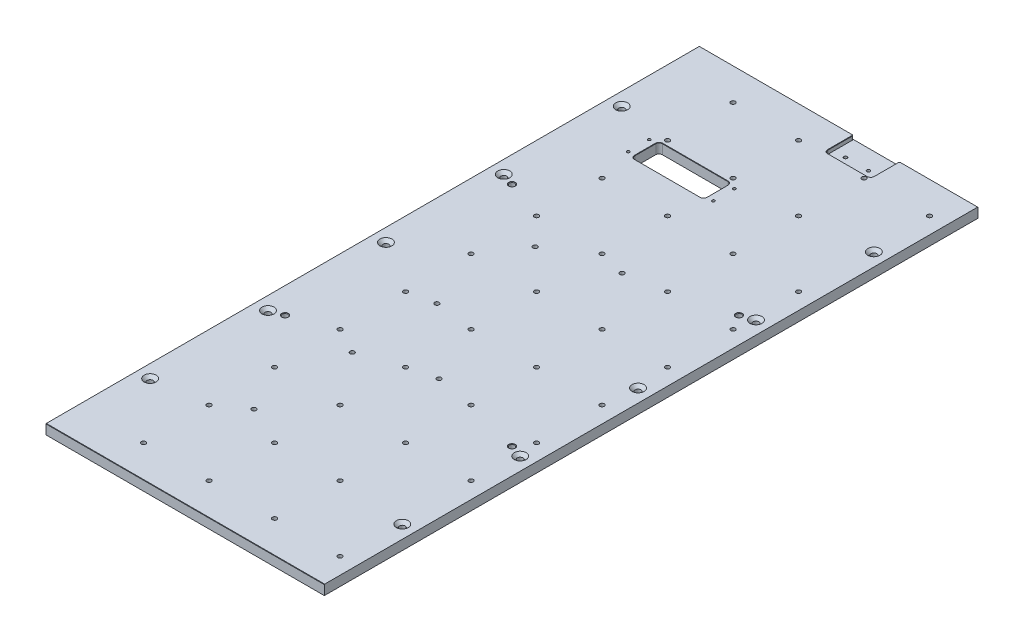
SolidWorks part; units mm, degrees
ref_plane "Ebene vorne" through (0, 0, 0) normal (0, 0, 1) x (1, 0, 0)
ref_plane "Ebene oben" through (0, 0, 0) normal (0, 1, 0) x (1, 0, 0)
ref_plane "Ebene rechts" through (0, 0, 0) normal (1, 0, 0) x (0, 0, -1)
sketch "Skizze1" plane through (0, 0, 0) normal (0, 1, 0) x (1, 0, 0)
  line L0 (-688, 499) -> (-748, 439)
  line L1 (-688, -499) -> (688, -499)
  line L2 (-688, -499) -> (-688, 499) construction
  line L3 (-688, 499) -> (688, 499)
  line L4 (688, -499) -> (688, 499) construction
  line L5 (-688, -499) -> (688, 499) construction
  line L6 (-688, 499) -> (688, -499) construction
  line L7 (-748, 439) -> (-748, -439)
  line L8 (-688, -499) -> (-748, -439)
  line L10 (688, -499) -> (748, -439)
  line L11 (748, -439) -> (748, 439)
  line L12 (748, 439) -> (688, 499)
  line L13 (-748, 0) -> (0, 0) construction
  point P0 (0, 0)
  dimension "D1" = 1496
  dimension "D2" = 998
  dimension "D3" = 60
  dimension "D4" = 45
extrude "Aufsatz-Linear austragen1" add sketch "Skizze1" along normal blind 15
hole_wizard "HORST900_P1_M8 Gewindebohrung1" positions "Skizze4" profile "Skizze5" tap size "M8" standard "DIN"
sketch "Skizze4" plane through (0, 15, 0) normal (0, 1, 0) x (1, 0, 0)
  line L0 (-688, -499) -> (688, -499) construction
  line L1 (0, -181.5) -> (-197.5, -181.5) construction
  line L2 (-197.5, -181.5) -> (0, 16) construction
  line L3 (0, 16) -> (197.5, -181.5) construction
  line L4 (197.5, -181.5) -> (0, -379) construction
  line L5 (0, -379) -> (-197.5, -181.5) construction
  line L7 (-139.6536, -321.1536) -> (139.6536, -41.8464) construction
  line L8 (-139.6536, -41.8464) -> (139.6536, -321.1536) construction
  circle A0 centre (0, -181.5) radius 197.5 construction
  point P21 (-139.6536, -321.1536)
  point P22 (139.6536, -41.8464)
  point P23 (-139.6536, -41.8464)
  point P24 (139.6536, -321.1536)
  dimension "D1" = 395
  dimension "D2" = 120
sketch "Skizze5" plane through (139.6536, 15, 321.1536) normal (1, 0, 0) x (0, 0, 1)
  line L0 (0, 0) -> (0, 15)
  line L1 (0, 15) -> (3.4, 15)
  line L2 (3.4, 15) -> (3.4, 0)
  line L5 (3.4, 0) -> (0, 0)
  line L11 (0, -6.35) -> (0, 107.95) construction
  dimension "Bohrerdurchmesser" = 6.8
  dimension "Bohrungstiefe" = 15
hole_wizard "HORST900_P2_M8 Gewindebohrung1" positions "Skizze6" profile "Skizze7" tap size "M8" standard "DIN"
sketch "Skizze6" plane through (0, 15, 0) normal (0, 1, 0) x (1, 0, 0)
  line L1 (240.8464, -139.6536) -> (520.1536, -139.6536) construction
  line L2 (240.8464, -139.6536) -> (240.8464, 139.6536) construction
  line L3 (240.8464, 139.6536) -> (520.1536, 139.6536) construction
  line L4 (520.1536, -139.6536) -> (520.1536, 139.6536) construction
  line L5 (240.8464, -139.6536) -> (520.1536, 139.6536) construction
  line L6 (240.8464, 139.6536) -> (520.1536, -139.6536) construction
  line L7 (748, -439) -> (748, 439) construction
  circle A0 centre (380.5, 0) radius 197.5 construction
  point P5 (520.1536, 139.6536)
  point P8 (240.8464, -139.6536)
  point P9 (240.8464, 139.6536)
  point P10 (520.1536, -139.6536)
  dimension "D1" = 395
  dimension "D2" = 170
sketch "Skizze7" plane through (520.1536, 15, 139.6536) normal (1, 0, 0) x (0, 0, 1)
  line L0 (0, 0) -> (0, 15)
  line L1 (0, 15) -> (3.4, 15)
  line L2 (3.4, 15) -> (3.4, 0)
  line L5 (3.4, 0) -> (0, 0)
  line L11 (0, -6.35) -> (0, 107.95) construction
  dimension "Bohrerdurchmesser" = 6.8
  dimension "Bohrungstiefe" = 15
hole_wizard "Raster_M8 Gewindebohrung3" positions "Skizze9" profile "Skizze10" tap size "M8" standard "DIN"
sketch "Skizze9" plane through (0, 15, 0) normal (0, 1, 0) x (1, 0, 0)
  point P0 (-700, -450)
  dimension "D1" = 700
  dimension "D2" = 450
sketch "Skizze10" plane through (-700, 15, 450) normal (1, 0, 0) x (0, 0, 1)
  line L0 (0, 0) -> (0, 15)
  line L1 (0, 15) -> (3.4, 15)
  line L2 (3.4, 15) -> (3.4, 0)
  line L5 (3.4, 0) -> (0, 0)
  line L11 (0, -6.35) -> (0, 107.95) construction
  dimension "Bohrerdurchmesser" = 6.8
  dimension "Bohrungstiefe" = 15
pattern_linear "HORST900P3_M8 Gewindebohrung1" count 2 spacing 150 along (0, 0, -1) of "HORST900_P1_M8 Gewindebohrung1"
hole_wizard "Formsenkung für M8 Senkschraube mit Innensechskant1" positions "Skizze2" profile "Skizze3" countersink size "M8" standard "DIN"
sketch "Skizze2" plane through (0, 15, 0) normal (0, 1, 0) x (1, 0, 0)
  line L1 (445, -360) -> (-445, -360)
  line L2 (445, -360) -> (445, 360)
  line L3 (445, 360) -> (-445, 360)
  line L4 (-445, -360) -> (-445, 360)
  line L5 (445, -360) -> (-445, 360) construction
  line L6 (445, 360) -> (-445, -360) construction
  line L7 (0, 0) -> (-610.081, 0) construction
  line L8 (-555, 210) -> (-555, -210) construction
  line L13 (0, 0) -> (0, -385.3386) construction
  line L18 (555, 210) -> (555, -210) construction
  line L19 (-20, 360) -> (-20, -360)
  line L21 (20, 360) -> (20, -360)
  line L22 (-555, 250) -> (-555, 210) construction
  line L24 (-555, -210) -> (-555, -250) construction
  line L26 (555, -210) -> (555, -250) construction
  line L28 (555, 210) -> (555, 250) construction
  line L29 (445, 0) -> (405, 0) construction
  point P2 (-445, 360)
  point P5 (445, -360)
  point P6 (445, 360)
  point P7 (-445, -360)
  point P98 (-555, 210)
  point P100 (-555, -210)
  point P123 (555, 210)
  point P125 (555, -210)
  point P139 (-20, 360)
  point P142 (20, 360)
  point P145 (-20, -360)
  point P148 (20, -360)
  point P150 (-20, 0)
  point P152 (20, 0)
  point P174 (-555, 250)
  point P177 (-555, -250)
  point P180 (555, -250)
  point P183 (555, 250)
  point P184 (-405, 360)
  point P186 (405, 360)
  point P188 (405, -360)
  point P190 (-405, -360)
  point P191 (-445, 0)
  point P193 (-405, 0)
  point P195 (445, 0)
  point P197 (405, 0)
  dimension "D1" = 890
  dimension "D2" = 720
  dimension "D3" = 40
  dimension "D4" = 1110
  dimension "D5" = 500
  dimension "D6" = 40
  dimension "D7" = 40
  dimension "D8" = 40
  dimension "D9" = 40
  dimension "D10" = 40
  dimension "D11" = 40
  dimension "D12" = 40
sketch "Skizze3" plane through (-445, 15, -360) normal (1, 0, 0) x (0, 0, 1)
  line L0 (0, 0) -> (0, 15)
  line L1 (0, 15) -> (4.5, 15)
  line L2 (4.5, 15) -> (4.5, 4.625)
  line L3 (4.5, 4.625) -> (9.125, 0)
  line L5 (9.125, 0) -> (0, 0)
  line L6 (-4.5, 4.625) -> (-9.125, 0) construction
  line L11 (0, -6.35) -> (0, 107.95) construction
  dimension "Bohrerdurchmesser" = 9
  dimension "Bohrungstiefe" = 15
  dimension "Senkdurchmesser (Oben)" = 18.25
  dimension "Senkwinkel (Oben)" = 90
sketch "Skizze8" plane through (0, 15, 0) normal (0, 1, 0) x (1, 0, 0)
  line L1 (100, 300) -> (200, 300)
  line L2 (95, 305) -> (95, 337)
  line L3 (100, 342) -> (200, 342)
  line L4 (205, 305) -> (205, 337)
  line L5 (95, 300) -> (205, 342) construction
  line L6 (95, 342) -> (205, 300) construction
  arc A0 (95, 305) -> (100, 300) centre (100, 305) ccw
  arc A1 (200, 300) -> (205, 305) centre (200, 305) ccw
  arc A2 (205, 337) -> (200, 342) centre (200, 337) ccw
  arc A3 (100, 342) -> (95, 337) centre (100, 337) ccw
  point P0 (150, 321)
  dimension "D5" = 5
  dimension "D1" = 150
  dimension "D2" = 110
  dimension "D3" = 42
  dimension "D4" = 321
extrude "Schnitt-Linear austragen1" cut sketch "Skizze8" against normal through all
hole_wizard "M5 Gewindebohrung1" positions "Skizze17" profile "Skizze18" tap size "M5" standard "DIN"
sketch "Skizze17" plane through (0, 15, 0) normal (0, 1, 0) x (1, 0, 0)
  line L0 (150, 342) -> (150, 300) construction
  line L1 (200, 342) -> (100, 342) construction
  line L2 (100, 300) -> (200, 300) construction
  line L3 (95, 321) -> (150, 321) construction
  line L4 (95, 337) -> (95, 305) construction
  line L5 (150, 321) -> (205, 321) construction
  line L6 (205, 305) -> (205, 337) construction
  point P17 (85, 337)
  point P19 (85, 305)
  point P21 (215, 305)
  point P23 (215, 337)
  dimension "D1" = 32
  dimension "D2" = 130
sketch "Skizze18" plane through (215, 15, -337) normal (1, 0, 0) x (0, 0, 1)
  line L0 (0, 0) -> (0, 13.2618)
  line L1 (0, 13.2618) -> (2.1, 12)
  line L2 (2.1, 12) -> (2.1, 0)
  line L5 (2.1, 0) -> (0, 0)
  line L10 (0, 13.2618) -> (-2.1, 12) construction
  line L11 (0, -6.35) -> (0, 107.95) construction
  dimension "Bohrerdurchmesser" = 4.2
  dimension "Bohrungstiefe" = 12
  dimension "Spitzenwinkel" = 118
sketch "Skizze11" plane through (0, 15, 0) normal (0, 1, 0) x (1, 0, 0)
  line L0 (0, 0) -> (0, 417.1845) construction
  line L1 (688, 499) -> (-688, 499) construction
  line L2 (-270, 455) -> (-270, 499) construction
  line L3 (-305.1, 499) -> (-234.9, 499)
  line L4 (-305.1, 499) -> (-305.1, 460)
  line L5 (-300.1, 455) -> (-239.9, 455)
  line L6 (-234.9, 499) -> (-234.9, 460)
  line L7 (234.9, 499) -> (234.9, 460)
  line L8 (300.1, 455) -> (239.9, 455)
  line L9 (305.1, 499) -> (305.1, 460)
  line L10 (305.1, 499) -> (234.9, 499)
  arc A0 (-234.9, 460) -> (-239.9, 455) centre (-239.9, 460) cw
  arc A1 (-300.1, 455) -> (-305.1, 460) centre (-300.1, 460) cw
  arc A2 (300.1, 455) -> (305.1, 460) centre (300.1, 460) ccw
  arc A3 (234.9, 460) -> (239.9, 455) centre (239.9, 460) ccw
  point P12 (-234.9, 455)
  point P15 (-305.1, 455)
  point P25 (305.1, 455)
  point P26 (234.9, 455)
  dimension "D3" = 5
  dimension "D1" = 44
  dimension "D2" = 70.2
  dimension "D4" = 270
extrude "Schnitt-Linear austragen2" cut sketch "Skizze11" against normal blind 6
fillet "Verrundung2" radius 2 4 edges at (-234.9, 12, -499) (-305.1, 12, -499) (305.1, 12, -499) (234.9, 12, -499)
hole_wizard "M6 Gewindebohrung1" positions "Skizze12" profile "Skizze13" tap size "M6" standard "DIN"
sketch "Skizze12" plane through (0, 9, 0) normal (0, 1, 0) x (1, 0, 0)
  line L0 (-270, 95.0617) -> (-270, 469.2) construction
  line L1 (-270, 469.2) -> (-287.5, 469.2) construction
  line L3 (-270, 469.2) -> (-252.5, 469.2) construction
  line L6 (-300.1, 455) -> (-239.9, 455) construction
  line L7 (-270, 469.2) -> (-270, 499) construction
  line L8 (-232.9, 499) -> (-307.1, 499) construction
  point P0 (-287.5, 469.2)
  point P4 (-252.5, 469.2)
  dimension "D1" = 35
  dimension "D2" = 14.2
sketch "Skizze13" plane through (-287.5, 9, -469.2) normal (1, 0, 0) x (0, 0, 1)
  line L0 (0, 0) -> (0, 9)
  line L1 (0, 9) -> (2.5, 9)
  line L2 (2.5, 9) -> (2.5, 0)
  line L5 (2.5, 0) -> (0, 0)
  line L11 (0, -6.35) -> (0, 107.95) construction
  dimension "Bohrerdurchmesser" = 5
  dimension "Bohrungstiefe" = 9
mirror "Spiegeln3" about plane through (0, 0, 0) normal (1, 0, 0) of "HORST900_P2_M8 Gewindebohrung1"
mirror "Spiegeln2" about plane through (0, 0, 0) normal (1, 0, 0) of "M6 Gewindebohrung1"
pattern_linear "Raster_M8 Gewindebohrung4" count 15 spacing 100 along (1, 0, 0) count 10 spacing 100 along (0, 0, -1) of "Raster_M8 Gewindebohrung3"
hole_wizard "Ø5.0mm Stiftloch1" positions "Skizze14" profile "Skizze15" hole size "Ø5.0" standard "DIN"
sketch "Skizze14" plane through (0, 15, 0) normal (0, 1, 0) x (1, 0, 0)
  line L1 (-500, -225) -> (500, -225)
  line L2 (-500, -225) -> (-500, 225)
  line L3 (-500, 225) -> (500, 225)
  line L4 (500, -225) -> (500, 225)
  line L5 (-500, -225) -> (500, 225) construction
  line L6 (-500, 225) -> (500, -225) construction
  point P2 (500, 225)
  point P5 (-500, -225)
  point P6 (-500, 225)
  point P7 (500, -225)
  dimension "D1" = 1000
  dimension "D2" = 450
sketch "Skizze15" plane through (500, 15, -225) normal (1, 0, 0) x (0, 0, 1)
  line L0 (0, 0) -> (0, 9.5022)
  line L1 (0, 9.5022) -> (2.5, 8)
  line L2 (2.5, 8) -> (2.5, 0)
  line L5 (2.5, 0) -> (0, 0)
  line L10 (0, 9.5022) -> (-2.5, 8) construction
  line L11 (0, -6.35) -> (0, 107.95) construction
  dimension "Bohrerdurchmesser" = 5
  dimension "Bohrungstiefe" = 8
  dimension "Spitzenwinkel" = 118
sketch "Skizze19" plane through (0, 15, 0) normal (0, 1, 0) x (1, 0, 0)
  line L0 (-748, -335.3333) -> (-584.3333, -499)
  line L1 (-748, 439) -> (-748, -439) construction
  line L2 (-688, -499) -> (688, -499) construction
  line L3 (-700, -450) -> (-666.6667, -416.6667) construction
  line L4 (-666.6667, -416.6667) -> (-633.3333, -383.3333) construction
  line L5 (-633.3333, -383.3333) -> (-600, -350) construction
  line L7 (-748, -335.3333) -> (-748, -499)
  line L8 (-748, -499) -> (-584.3333, -499)
  line L9 (0, 0) -> (-867.3636, 0) construction
  line L10 (0, 0) -> (0, 198.8508) construction
  line L11 (748, 335.3333) -> (584.3333, 499)
  line L12 (748, 335.3333) -> (748, 499)
  line L13 (748, 499) -> (584.3333, 499)
  line L14 (748, -499) -> (584.3333, -499)
  line L15 (-748, 499) -> (-584.3333, 499)
  line L16 (-748, 335.3333) -> (-748, 499)
  line L17 (-748, 335.3333) -> (-584.3333, 499)
  line L18 (748, -335.3333) -> (748, -499)
  line L19 (748, -335.3333) -> (584.3333, -499)
extrude "Schnitt-Linear austragen4" cut sketch "Skizze19" against normal through all
fillet "Verrundung1" radius 10 8 edges at (-584.3333, 7.5, 499) (584.3333, 7.5, 499) (748, 7.5, 335.3333) (748, 7.5, -335.3333) (584.3333, 7.5, -499) (-584.3333, 7.5, -499) (-748, 7.5, -335.3333) (-748, 7.5, 335.3333)
chamfer "Fase1" distance 0.5 angle 45 40 edges at (0, 15, -499) (-234.3142, 15, -498.4142) (234.3142, 15, -498.4142) (-234.9, 15, -478.5) (234.9, 15, -478.5) (-236.3645, 15, -456.4645) (236.3645, 15, -456.4645) (-270, 15, -455) (270, 15, -455) (-303.6355, 15, -456.4645) (303.6355, 15, -456.4645) (-305.1, 15, -478.5) (305.1, 15, -478.5) (-305.6858, 15, -498.4142) (305.6858, 15, -498.4142) (-443.6456, 15, -499) (443.6456, 15, -499) (-748, 15, 0) (748, 15, 0) (0, 15, 499) (150, 15, -300) (203.5355, 15, -301.4645) (96.4645, 15, -301.4645) (205, 15, -321) (95, 15, -321) (203.5355, 15, -340.5355) (96.4645, 15, -340.5355) (150, 15, -342) (-666.1667, 15, 417.1667) (-584.018, 15, 498.2388) (-584.018, 15, -498.2388) (584.018, 15, -498.2388) (-666.1667, 15, -417.1667) (666.1667, 15, -417.1667) (-747.2388, 15, -335.018) (747.2388, 15, -335.018) (-747.2388, 15, 335.018) (747.2388, 15, 335.018) (666.1667, 15, 417.1667) (584.018, 15, 498.2388)
ref_plane "Ebene1" through (425, 0, 0) normal (1, 0, 0) x (0, 0, -1)
ref_plane "Ebene2" through (-425, 0, 0) normal (1, 0, 0) x (0, 0, -1)
split "Abspalten3" trim tools "Ebene1", "Ebene2", "Ebene rechts" bodies to split 128 resulting bodies 139
hole_wizard "Formsenkung für M8 Senkschraube mit Innensechskant2" positions "Skizze20" profile "Skizze21" countersink size "M8" standard "DIN"
sketch "Skizze20" plane through (0, 15, 0) normal (0, 1, 0) x (1, 0, 0)
  line L0 (405, -360) -> (405, -180) construction
  line L1 (405, -180) -> (405, 0) construction
  line L2 (405, 0) -> (405, 180) construction
  line L3 (405, 180) -> (405, 360) construction
  line L6 (20, 360) -> (20, 180) construction
  line L7 (20, 180) -> (20, 0) construction
  line L8 (20, 0) -> (20, -180) construction
  line L9 (20, -180) -> (20, -360) construction
  line L12 (20, -180) -> (405, -180) construction
  line L16 (405, 180) -> (20, 180) construction
  point P0 (405, 180)
  point P2 (20, 180)
  point P4 (405, -180)
  point P6 (20, -180)
sketch "Skizze21" plane through (405, 15, -180) normal (1, 0, 0) x (0, 0, 1)
  line L0 (0, 0) -> (0, 15)
  line L1 (0, 15) -> (4.5, 15)
  line L2 (4.5, 15) -> (4.5, 4.625)
  line L3 (4.5, 4.625) -> (9.125, 0)
  line L5 (9.125, 0) -> (0, 0)
  line L6 (-4.5, 4.625) -> (-9.125, 0) construction
  line L11 (0, -6.35) -> (0, 107.95) construction
  dimension "Bohrerdurchmesser" = 9
  dimension "Bohrungstiefe" = 15
  dimension "Senkdurchmesser (Oben)" = 18.25
  dimension "Senkwinkel (Oben)" = 90
hole_wizard "HORST1400 M10 Gewindebohrung1" positions "Skizze22" profile "Skizze23" tap size "M10" standard "DIN"
sketch "Skizze22" plane through (0, 15, 0) normal (0, 1, 0) x (1, 0, 0)
  line L0 (212.5, 0) -> (212.5, -353.962) construction
  line L2 (212.5, 0) -> (130.9707, 0) construction
  line L4 (0, -498.5) -> (0, 498.5) construction
  line L6 (39.2588, -173.2412) -> (385.7412, -173.2412) construction
  line L7 (39.2588, -173.2412) -> (39.2588, 173.2412) construction
  line L8 (39.2588, 173.2412) -> (385.7412, 173.2412) construction
  line L9 (385.7412, -173.2412) -> (385.7412, 173.2412) construction
  circle A0 centre (212.5, 0) radius 245 construction
  point P0 (39.2588, -173.2412)
  point P2 (385.7412, 173.2412)
  point P4 (385.7412, -173.2412)
  point P6 (39.2588, 173.2412)
  dimension "D1" = 490
  dimension "D2" = 212.5
sketch "Skizze23" plane through (39.2588, 15, 173.2412) normal (1, 0, 0) x (0, 0, 1)
  line L0 (0, 0) -> (0, 15)
  line L1 (0, 15) -> (4.25, 15)
  line L2 (4.25, 15) -> (4.25, 0.775)
  line L3 (4.25, 0.775) -> (5.025, 0)
  line L5 (5.025, 0) -> (0, 0)
  line L6 (-4.25, 0.775) -> (-5.025, 0) construction
  line L11 (0, -6.35) -> (0, 107.95) construction
  dimension "Bohrerdurchmesser" = 8.5
  dimension "Bohrungstiefe" = 15
  dimension "Senkdurchmesser (Oben)" = 10.05
  dimension "Senkwinkel (Oben)" = 90
